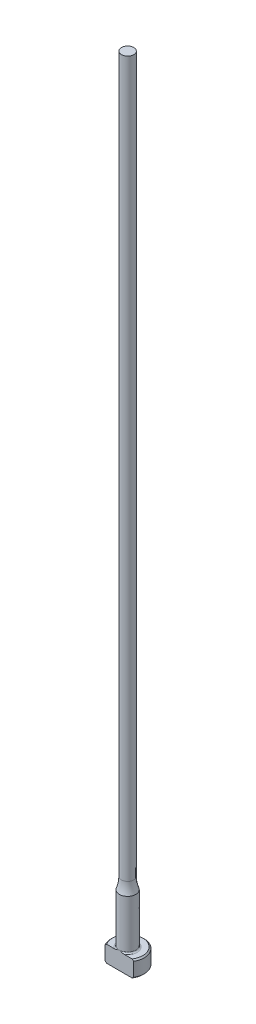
SolidWorks part; units mm, degrees
ref_plane "Front Plane" through (0, 0, 0) normal (0, 0, 1) x (1, 0, 0)
ref_plane "Top Plane" through (0, 0, 0) normal (0, 1, 0) x (1, 0, 0)
ref_plane "Right Plane" through (0, 0, 0) normal (1, 0, 0) x (0, 0, -1)
sketch "Sketch1" plane through (0, 0, 0) normal (0, 0, 1) x (1, 0, 0)
  line L0 (0, 259.9588) -> (0, -15.1925) construction
  line L1 (0, 0) -> (-3.175, 0)
  line L2 (-3.175, 0) -> (-3.175, 3.175)
  line L3 (-3.175, 3.175) -> (-1.5875, 3.175)
  line L4 (-1.19, 14.9114) -> (-1.19, 152.4)
  line L5 (-1.19, 152.4) -> (0, 152.4)
  line L6 (0, 152.4) -> (0, 0)
  line L7 (-1.5875, 3.175) -> (-1.5875, 12.7)
  arc A0 (-1.5875, 12.7) -> (-1.19, 14.9114) centre (-7.54, 14.9114) ccw
  point P13 (-1.5875, 0)
  dimension "D1" = 6.35
  dimension "L" = 152.4
  dimension "D2" = 3.175
  dimension "H" = 6.35
  dimension "T" = 3.175
  dimension "D" = 2.38
  dimension "S" = 12.7
revolve "Revolve1" add sketch "Sketch1" angle 360 about L0
chamfer "Chamfer1" distance 0.254 angle 45 2 edges at (0, 3.175, 3.175) (0, 0, 3.175)
fillet "Fillet1" radius 0.254 1 edges at (0, 3.175, 1.5875)
sketch "Sketch2" plane through (0, 0, 0) normal (0, -1, 0) x (1, 0, 0)
  line L0 (-2.7496, 1.5875) -> (2.7496, 1.5875)
  arc A0 (2.7496, 1.5875) -> (-2.7496, 1.5875) centre (0, 0) ccw
  circle A1 centre (0, 0) radius 3.175 construction
  circle A2 centre (0, 0) radius 1.5875 construction
extrude "Cut-Extrude1" cut sketch "Sketch2" against normal through all
